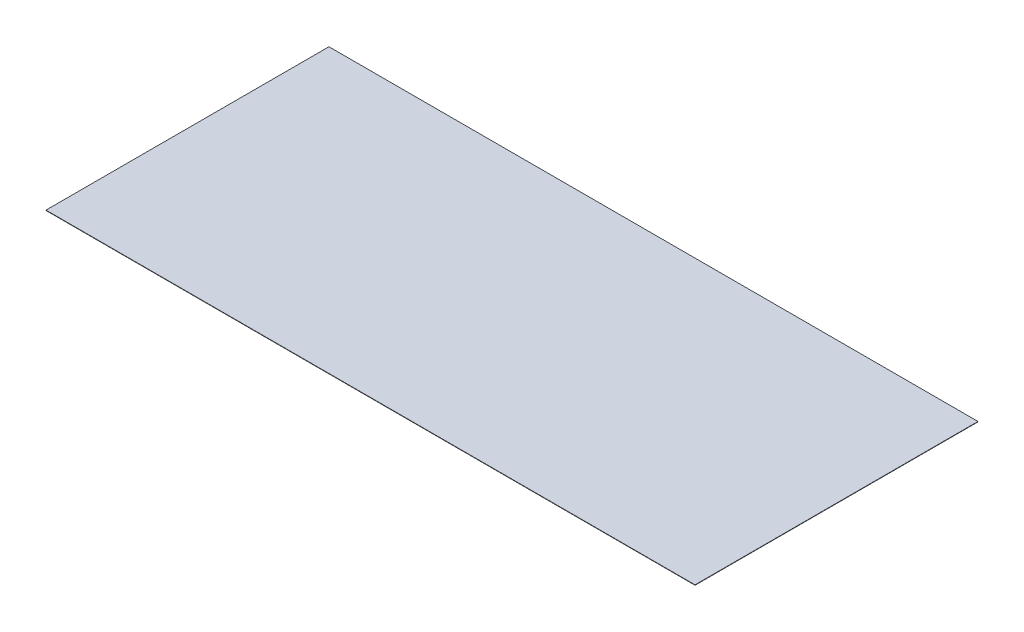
SolidWorks part; units mm, degrees
ref_plane "Front Plane" through (0, 0, 0) normal (0, 0, 1) x (1, 0, 0)
ref_plane "Top Plane" through (0, 0, 0) normal (0, 1, 0) x (1, 0, 0)
ref_plane "Right Plane" through (0, 0, 0) normal (1, 0, 0) x (0, 0, -1)
sketch "Sketch1" plane through (0, 0, 0) normal (0, 1, 0) x (1, 0, 0)
  line L1 (0, 0) -> (85.1, 0)
  line L2 (0, 0) -> (0, 37.1)
  line L3 (0, 37.1) -> (85.1, 37.1)
  line L4 (85.1, 0) -> (85.1, 37.1)
  dimension "D1" = 37.1
  dimension "D2" = 85.1
extrude "Boss-Extrude1" add sketch "Sketch1" along normal blind 0.05
